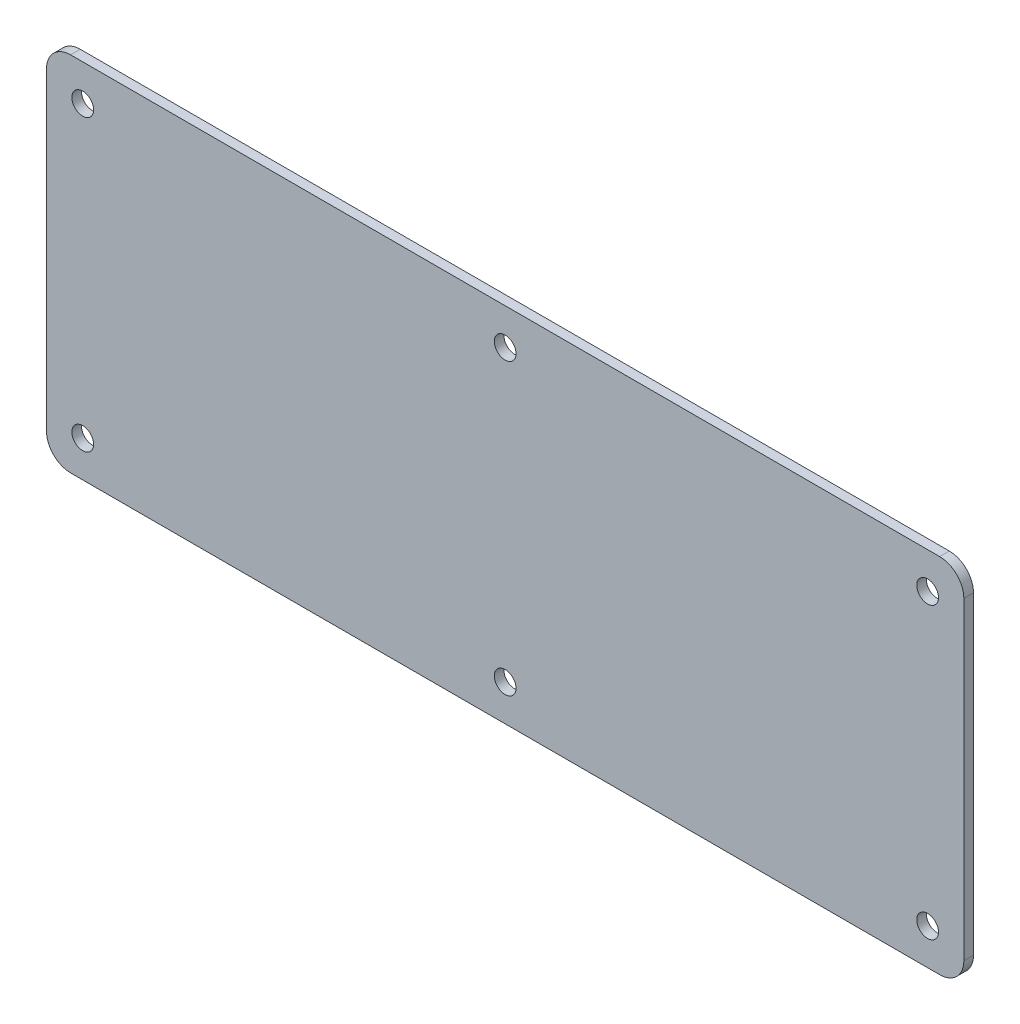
SolidWorks part; units mm, degrees
ref_plane "Face" through (0, 0, 0) normal (0, 0, 1) x (1, 0, 0)
ref_plane "Dessus" through (0, 0, 0) normal (0, 1, 0) x (1, 0, 0)
ref_plane "Droite" through (0, 0, 0) normal (1, 0, 0) x (0, 0, -1)
sketch "Esquisse1" plane through (0, 0, 0) normal (0, 0, 1) x (1, 0, 0)
  line L0 (4.9668, 40.2847) -> (179.9668, 40.2847) construction
  line L1 (-0.0332, 55.2847) -> (359.9668, 55.2847)
  line L2 (-10.0332, 45.2847) -> (-10.0332, -84.7153)
  line L3 (-0.0332, -94.7153) -> (359.9668, -94.7153)
  line L4 (369.9668, 45.2847) -> (369.9668, -84.7153)
  line L5 (4.9668, 40.2847) -> (4.9668, -79.7153) construction
  arc A0 (359.9668, 55.2847) -> (369.9668, 45.2847) centre (359.9668, 45.2847) cw
  arc A1 (-10.0332, 45.2847) -> (-0.0332, 55.2847) centre (-0.0332, 45.2847) cw
  arc A2 (-0.0332, -94.7153) -> (-10.0332, -84.7153) centre (-0.0332, -84.7153) cw
  arc A3 (369.9668, -84.7153) -> (359.9668, -94.7153) centre (359.9668, -84.7153) cw
  circle A4 centre (4.9668, 40.2847) radius 4.5
  circle A5 centre (179.9668, 40.2847) radius 4.5
  circle A6 centre (354.9668, 40.2847) radius 4.5
  circle A7 centre (4.9668, -79.7153) radius 4.5
  circle A8 centre (179.9668, -79.7153) radius 4.5
  circle A9 centre (354.9668, -79.7153) radius 4.5
  point P6 (369.9668, 55.2847)
  point P9 (-10.0332, 55.2847)
  point P12 (-10.0332, -94.7153)
  dimension "D3" = 10
  dimension "D4" = 9
  dimension "D1" = 380
  dimension "D2" = 150
  dimension "D5" = 15
  dimension "D6" = 15
  dimension "D7" = 90
extrude "Extrusion1" add sketch "Esquisse1" along normal blind 4
